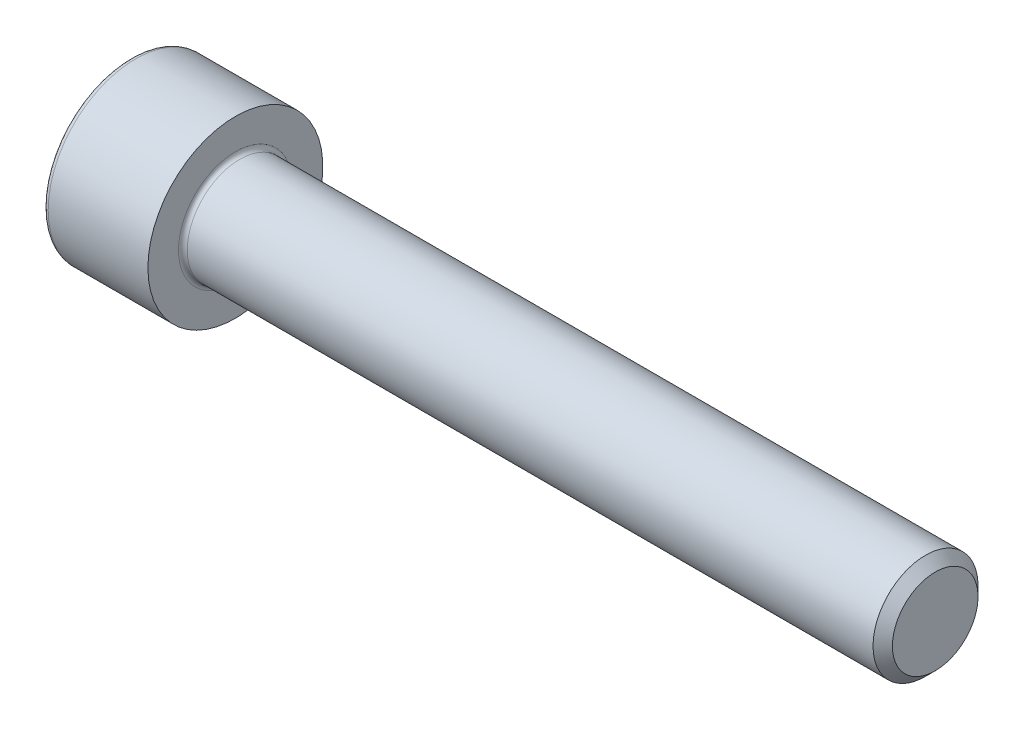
SolidWorks part; units mm, degrees
revolve "Base-Revolve" add sketch "BodySke"
sketch "BodySke" plane through (0, 0, 0) normal (0, 0, 1) x (1, 0, 0)
  line L0 (0, 0) -> (0, 5)
  line L1 (0, 5) -> (6, 5)
  line L2 (6, 5) -> (6, 3)
  line L3 (6, 3) -> (45.4455, 3)
  line L4 (46, 2.4455) -> (46, 0)
  line L5 (46, 0) -> (0, 0)
  line L6 (-31.75, 0) -> (127, 0) construction
  line L8 (46, 2.4455) -> (45.4455, 3)
  line L10 (46, -2.4455) -> (45.4455, -3) construction
  line L11 (7, 9.525) -> (7, 3.175) construction
  line L12 (6, 9.525) -> (6, 3.175) construction
  line L13 (-14, 9.525) -> (-14, 3.175) construction
fillet "Fillet1" radius 0.25 1 edges at (6, 0, 3)
fillet "Fillet2" radius 0.3 1 edges at (0, 0, 5)
ref_plane "Plane1" through (0, 0, 0) normal (0, 0, 1) x (1, 0, 0)
ref_plane "Plane2" through (0, 0, 0) normal (0, 1, 0) x (1, 0, 0)
ref_plane "Plane3" through (0, 0, 0) normal (1, 0, 0) x (0, 0, -1)
sketch "Sketch2" plane through (0, 0, 0) normal (0, 0, 1) x (1, 0, 0)
  line L0 (0, 2.542) -> (3, 2.542)
  line L1 (3, 2.542) -> (4.4676, 0)
  line L2 (-31.75, 0) -> (127, 0) construction
  line L3 (4.4676, 0) -> (0, 0)
  line L4 (0, 0) -> (0, 2.542)
  line L6 (0, 0) -> (47.625, 0) construction
revolve "Hex-PreBroach" cut sketch "Sketch2" angle 360 about L6
sketch "Sketch3" plane through (0, 0, 0) normal (-1, 0, 0) x (0, 0.5, 0.866)
  line L0 (1.4676, 2.542) -> (-1.4676, 2.542)
  line L1 (-1.4676, 2.542) -> (-2.9352, 0)
  line L2 (1.4676, 2.542) -> (2.9352, 0)
  line L3 (1.4676, -2.542) -> (2.9352, 0)
  line L4 (1.4676, -2.542) -> (-1.4676, -2.542)
  line L5 (-1.4676, -2.542) -> (-2.9352, 0)
extrude "Hex" cut sketch "Sketch3" against normal blind 3
sketch "ThdSchSke" plane through (0, 0, 0) normal (0, 0, 1) x (1, 0, 0)
  line L0 (9, -2.4455) -> (8.6117, -3)
  line L1 (9, -2.4455) -> (9.3883, -3)
  line L2 (9.3883, -3) -> (9.3883, -3.75)
  line L3 (-3.175, 0) -> (5.1513, 0) construction
  line L4 (0, 4.7) -> (0, -4.7) construction
  line L5 (9.3883, -3.75) -> (8.6117, -3.75)
  line L6 (8.6117, -3.75) -> (8.6117, -3)
revolve "ThreadSchematic" [suppressed] cut sketch "ThdSchSke" angle 360 about L3
pattern_linear "ThdSchPat" [suppressed]
equation "\"D2@Sketch3\" = \"Hex_size@Sketch3\" / 2"
equation "\"D1@Sketch3\" = \"Hex_size@Sketch3\" / 2"
equation "\"D1@Sketch2\" = \"Hex_size@Sketch3\" / 2"
equation "\"Thread_minor@ThreadCosmetic\"  =  \"Minor_dia@BodySke\""
equation "\"Depth@Sketch2\" =  \"Key_eng@Hex\""
equation "\"Thread_length@ThreadCosmetic\" = ((sgn( (\"Length@BodySke\" - \"Advance@BodySke\" * 3.0) - \"Thread_nom@BodySke\" )-1)*( (\"Length@BodySke\" - \"Advance@BodySke\" * 3.0) - \"Thread_nom@BodySke\" ))/-2+ \"Thread_no"
equation "\"Thread_minor@ThdSchSke\" = \"Minor_dia@BodySke\""
equation "\"Diameter@ThdSchSke\" = \"Diameter@BodySke\""
equation "\"Overcut@ThdSchSke\" = \"Diameter@BodySke\" * 1.25"
equation "\"Start@ThdSchSke\" = \"Head_ht@BodySke\" + \"Length@BodySke\" - \"Thread_length@ThreadCosmetic\"  '---Non-countersunk---"
equation "\"Num_threads@ThdSchPat\" = int( \"Thread_length@ThreadCosmetic\" / \"Advance@BodySke\" + 0.999 )  + 1"
equation "\"Advance@ThdSchPat\" = \"Thread_length@ThreadCosmetic\" /  (\"Num_threads@ThdSchPat\" - 1) 'relax it"
equation "\"Num_threads@ThdSchPat\" = \"Num_threads@ThdSchPat\" - sgn( \"Num_threads@ThdSchPat\" - 1) '---chamfered tips only---"
